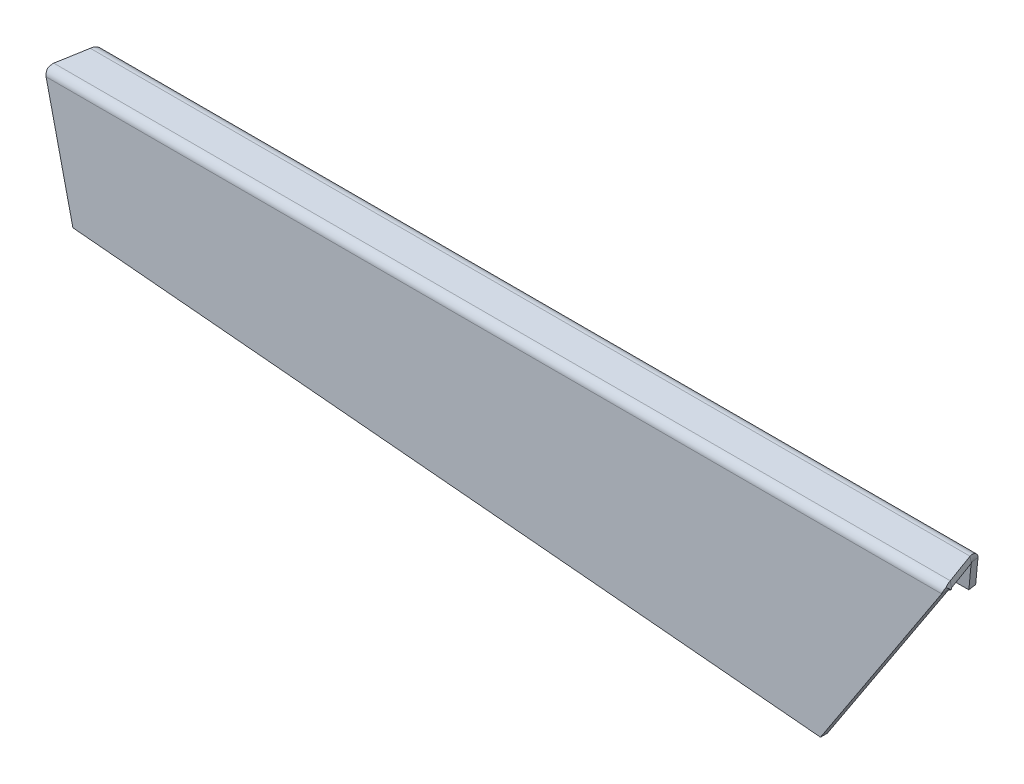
SolidWorks part; units mm, degrees
ref_plane "前视基准面" through (0, 0, 0) normal (0, 0, 1) x (1, 0, 0)
ref_plane "上视基准面" through (0, 0, 0) normal (0, 1, 0) x (1, 0, 0)
ref_plane "右视基准面" through (0, 0, 0) normal (1, 0, 0) x (0, 0, -1)
sketch "草图1" plane through (0, 0, 0) normal (0, 0, 1) x (1, 0, 0)
  line L0 (0, 0) -> (-1040, 0) construction
  line L1 (0, 0) -> (-20, 80)
  line L2 (0, 0) -> (-143, -218)
  line L3 (-20, 80) -> (-1010, 80)
  line L4 (-1010, 80) -> (-1040, 0)
  line L5 (-1008, -140) -> (-143, -218)
  line L6 (-1040, 0) -> (-1008, -140)
  dimension "D1" = 1040
  dimension "D2" = 218
  dimension "D3" = 143
  dimension "D4" = 298
  dimension "D5" = 20
  dimension "D6" = 990
  dimension "D7" = 32
  dimension "D8" = 140
sheet metal parameters "钣金1" thickness 8 parameters "D1"=2
base flange "基体-法兰1" sketch "草图1" thickness 8 reverse thickness direction yes parameters "D1"=2
sketch "草图3" plane through (0, 0, 8) normal (0, 0, 1) x (1, 0, 0)
  line L2 (-20, 0) -> (-1010, 0)
  line L3 (-20, 0) -> (-1010, 0)
  dimension "D1" = 80
sketched bend "绘制的折弯1" parameters "D1"=2
bend "草图折弯1" bend radius 2 bend angle 80 parameters "D5"=1
sketch "草图4" plane through (0, 5.4436, 0.9598) normal (0, 0.9848, 0.1736) x (1, 0, 0)
  line L2 (-20, 37.0534) -> (-1010, 37.0534)
  line L3 (-20, 37.0534) -> (-1010, 37.0534)
  dimension "D1" = 40
sketched bend "绘制的折弯2" parameters "D1"=2
bend "草图折弯2" bend radius 2 bend angle 90 parameters "D5"=2
flat pattern "平板型式1"
sketch "折弯-线1" plane through (0, 0, 0) normal (0, 1, 0) x (-1, 0, 0)
bend of the flat pattern "展开-<草图折弯1>1"
bend of the flat pattern "展开-<草图折弯2>1"
